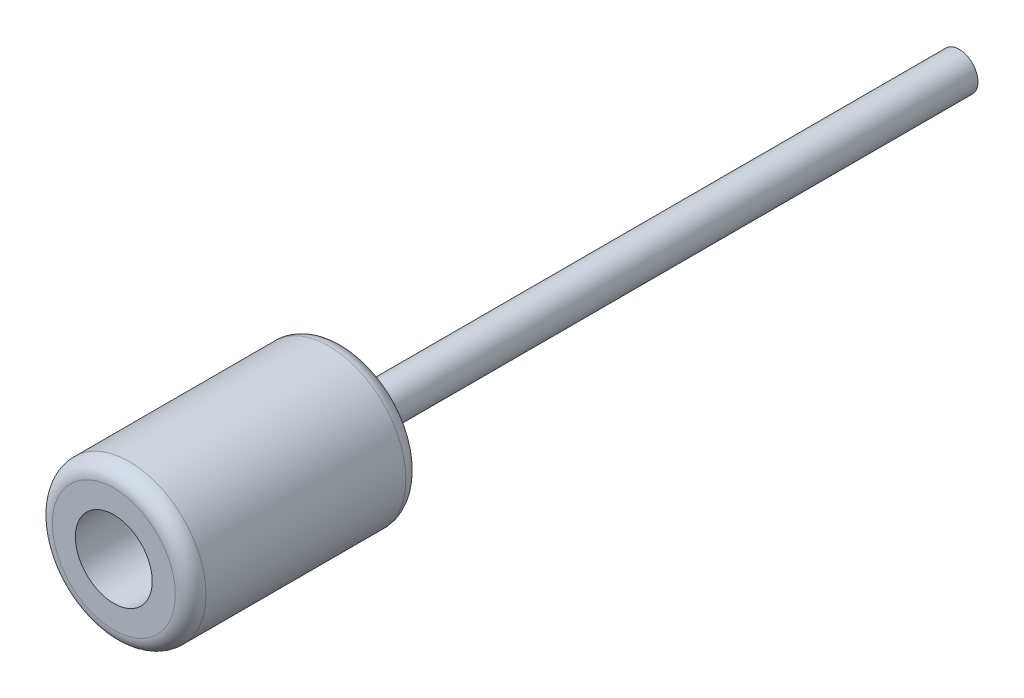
SolidWorks part; units mm, degrees
ref_plane "Front Plane" through (0, 0, 0) normal (0, 0, 1) x (1, 0, 0)
ref_plane "Top Plane" through (0, 0, 0) normal (0, 1, 0) x (1, 0, 0)
ref_plane "Right Plane" through (0, 0, 0) normal (1, 0, 0) x (0, 0, -1)
sketch "Sketch1" plane through (0, 0, 0) normal (0, 0, 1) x (1, 0, 0)
  circle A0 centre (0, 0) radius 12.7
  dimension "D1" = 25.4
extrude "Boss-Extrude1" add sketch "Sketch1" along normal blind 38.1
shell "Shell1" thickness 6.35
fillet "Fillet1" radius 2.54 1 edges at (12.7, 0, 0)
fillet "Fillet2" radius 2.54 1 edges at (12.7, 0, 38.1)
sketch "Sketch2" plane through (0, 0, 0) normal (0, 0, -1) x (-1, 0, 0)
  circle A0 centre (0, 0) radius 3.1115
  dimension "D1" = 6.223
extrude "Boss-Extrude2" add sketch "Sketch2" along normal blind 101.6
